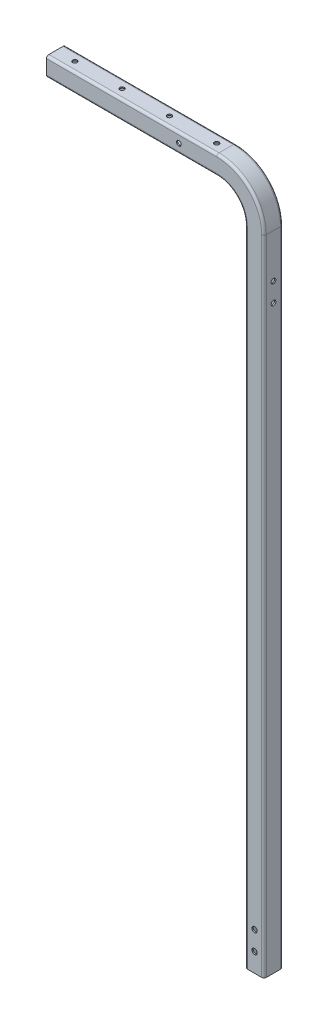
SolidWorks part; units mm, degrees
ref_plane "Front" through (0, 0, 0) normal (0, 0, 1) x (1, 0, 0)
ref_plane "Top" through (0, 0, 0) normal (0, 1, 0) x (1, 0, 0)
ref_plane "Right" through (0, 0, 0) normal (1, 0, 0) x (0, 0, -1)
sketch "Sketch1" plane through (0, 0, 0) normal (0, 0, 1) x (1, 0, 0)
  line L0 (0, 0) -> (228.6, 0)
  line L1 (279.4, -50.8) -> (279.4, -914.4)
  arc A0 (279.4, -50.8) -> (228.6, 0) centre (228.6, -50.8) ccw
  dimension "D1" = 50.8
  dimension "D2" = 279.4
  dimension "D3" = 914.4
sketch "Sketch2"
  line L0 (-12.7, 12.7) -> (12.7, 12.7)
  line L1 (-12.7, 12.7) -> (-12.7, -12.7)
  line L2 (12.7, -12.7) -> (-12.7, -12.7)
  line L3 (12.7, -12.7) -> (12.7, 12.7)
  line L4 (12.7, 12.7) -> (-12.7, -12.7) construction
  dimension "square" = 25.4
sweep "Base-Sweep" add profiles "Sketch2" path "Sketch1"
fillet "Fillet1" radius 3.175 12 edges at (273.5013, -5.8987, 12.7) (273.5013, -5.8987, -12.7) (255.5408, -23.8592, -12.7) (255.5408, -23.8592, 12.7) (292.1, -482.6, 12.7) (292.1, -482.6, -12.7) (266.7, -482.6, -12.7) (266.7, -482.6, 12.7) (114.3, 12.7, 12.7) (114.3, 12.7, -12.7) (114.3, -12.7, -12.7) (114.3, -12.7, 12.7)
shell "Shell1" thickness 1.5875
hole_wizard "Ø6.0 (6) Diameter Hole1" positions "Sketch9" profile "Sketch10" hole size "Ø6.0" standard "ANSI Metric"
sketch "Sketch9" plane through (0, 12.7, 0) normal (0, 1, 0) x (1, 0, 0)
  line L0 (215.9, 0) -> (228.6, 0) construction
  line L1 (228.6, -9.525) -> (228.6, 9.525) construction
  point P0 (215.9, 0)
  dimension "D1" = 12.7
sketch "Sketch10" plane through (215.9, 12.7, 0) normal (1, 0, 0) x (0, 0, 1)
  line L0 (0, 0) -> (0, 927.1)
  line L1 (0, 927.1) -> (3, 927.1)
  line L2 (3, 927.1) -> (3, 0)
  line L5 (3, 0) -> (0, 0)
  line L11 (0, -6.35) -> (0, 107.95) construction
  dimension "Thru Hole Dia." = 6
  dimension "Thru Hole Depth" = 927.1
pattern_linear "LPattern3" count 4 spacing 63.5 along (-1, 0, 0) of "Ø6.0 (6) Diameter Hole1"
sketch "Sketch5" plane through (292.1, 0, 0) normal (1, 0, 0) x (0, 0, -1)
  line L4 (-9.525, 12.7) -> (9.525, 12.7) construction
  line L5 (0, 50) -> (0, -50) construction
  circle A4 centre (0, -109.5375) radius 3.175
  circle A5 centre (0, -134.9375) radius 3.175
  dimension "D1" = 122.2375
  dimension "D3" = 6.35
  dimension "D2" = 25.4
extrude "cont_mtg" cut sketch "Sketch5" against normal through all
hole_wizard "1/4 (0.25) Diameter Hole1" positions "Sketch7" profile "Sketch6" hole size "1/4" standard "Ansi Inch"
sketch "Sketch7" plane through (0, 0, 12.7) normal (0, 0, 1) x (1, 0, 0)
  line L1 (0, 9.525) -> (0, -9.525) construction
  line L2 (0, 0) -> (228.6, 0) construction
  point P0 (177.8, 0)
  point P1 (355.6, 0)
  dimension "D1" = 177.8
  dimension "D2" = 355.6
sketch "Sketch6" plane through (177.8, 0, 12.7) normal (1, 0, 0) x (0, -1, 0)
  line L0 (0, 0) -> (0, 25.4)
  line L1 (0, 25.4) -> (3.175, 25.4)
  line L2 (3.175, 25.4) -> (3.175, 0)
  line L5 (3.175, 0) -> (0, 0)
  line L11 (0, -6.35) -> (0, 107.95) construction
  dimension "Thru Hole Dia." = 6.35
  dimension "Thru Hole Depth" = 25.4
sketch "Sketch8" plane through (0, 0, -12.7) normal (0, 0, -1) x (-1, 0, 0)
  line L1 (-269.875, -914.4) -> (-288.925, -914.4) construction
  line L2 (-279.4, -50.8) -> (-279.4, -914.4) construction
  circle A1 centre (-279.4, -889) radius 3.5719
  dimension "D1" = 7.1437
  dimension "D3" = 25.4
extrude "Cut-Extrude1" cut sketch "Sketch8" against normal through all
pattern_linear "LPattern2" count 2 spacing 25.4 along (0, 1, 0) of "Cut-Extrude1"
